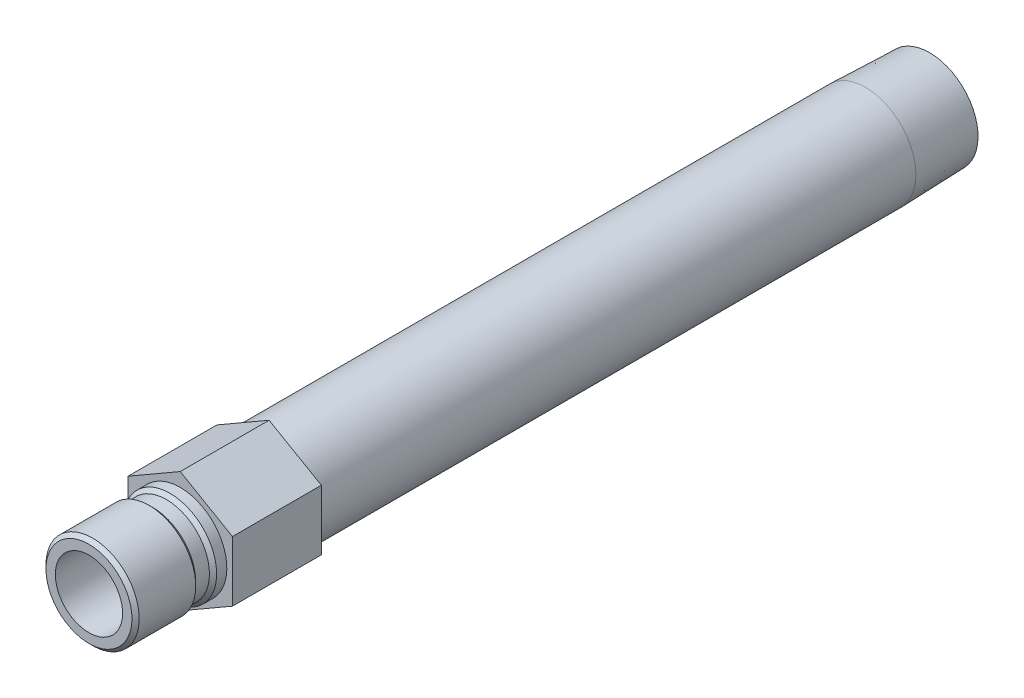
SolidWorks part; units mm, degrees
ref_plane "Front Plane" through (0, 0, 0) normal (0, 0, 1) x (1, 0, 0)
ref_plane "Top Plane" through (0, 0, 0) normal (0, 1, 0) x (1, 0, 0)
ref_plane "Right Plane" through (0, 0, 0) normal (1, 0, 0) x (0, 0, -1)
sketch "Sketch1" plane through (0, 0, 0) normal (1, 0, 0) x (0, 0, -1)
  line L0 (0, 0) -> (-22.479, 0) construction
  line L1 (-19.304, 7.112) -> (-19.304, 9.0932)
  line L2 (-5.8166, 9.0932) -> (-5.8166, 0) construction
  line L3 (-18.542, 9.8552) -> (-6.5786, 9.8552)
  line L4 (0, 10.668) -> (0, 0) construction
  line L5 (-5.8166, 9.0932) -> (-2.921, 9.0932)
  line L6 (-2.159, 9.8552) -> (0, 9.8552)
  line L7 (0, 9.8552) -> (0, 10.668)
  line L8 (-5.8166, 9.0932) -> (-6.5786, 9.8552)
  line L9 (-2.921, 9.0932) -> (-2.159, 9.8552)
  line L10 (-19.304, 9.0932) -> (-18.542, 9.8552)
  line L11 (-19.304, 7.112) -> (-1.524, 7.112)
  line L12 (0, 10.668) -> (144.9324, 10.668)
  line L13 (144.9324, 10.668) -> (158.496, 10.2441)
  line L14 (158.496, 10.2441) -> (158.496, 7.8994)
  line L15 (0, 9.8552) -> (18.796, 9.8552) construction
  line L16 (18.796, 9.8552) -> (18.796, 0) construction
  line L17 (18.796, 0) -> (0, 0) construction
  line L18 (-1.524, 7.112) -> (-1.1053, 7.8994)
  line L19 (-1.1053, 7.8994) -> (158.496, 7.8994)
  dimension "D1" = 19.304
  dimension "D2" = 2.8956
  dimension "D3" = 0.762
  dimension "D4" = 45
  dimension "D5" = 13.4874
  dimension "D6" = 45
  dimension "D7" = 1.79
  dimension "D8" = 13.5636
  dimension "D9" = 177.8
  dimension "D10" = 3.175
  dimension "D11" = 38.1
  dimension "D12" = 14.224
  dimension "D13" = 21.336
  dimension "D14" = 19.7104
  dimension "D15" = 15.7988
  dimension "D16" = 118
  dimension "D17" = 17.78
revolve "Revolve1" add sketch "Sketch1" angle 360 about L0
sketch "Sketch2" plane through (0, 0, 0) normal (0, 0, 1) x (1, 0, 0)
  line L1 (-11.049, 6.3791) -> (-11.049, -6.3791)
  line L2 (-11.049, -6.3791) -> (0, -12.7583)
  line L3 (0, -12.7583) -> (11.049, -6.3791)
  line L4 (11.049, -6.3791) -> (11.049, 6.3791)
  line L5 (11.049, 6.3791) -> (0, 12.7583)
  line L6 (0, 12.7583) -> (-11.049, 6.3791)
  circle A0 centre (0, 0) radius 11.049 construction
  circle A1 centre (0, 0) radius 7.112 construction
  circle A2 centre (0, 0) radius 7.112
  dimension "D1" = 22.098
extrude "Boss-Extrude1" add sketch "Sketch2" against normal up to vertex (18.796 mm away) from vertex at 0
